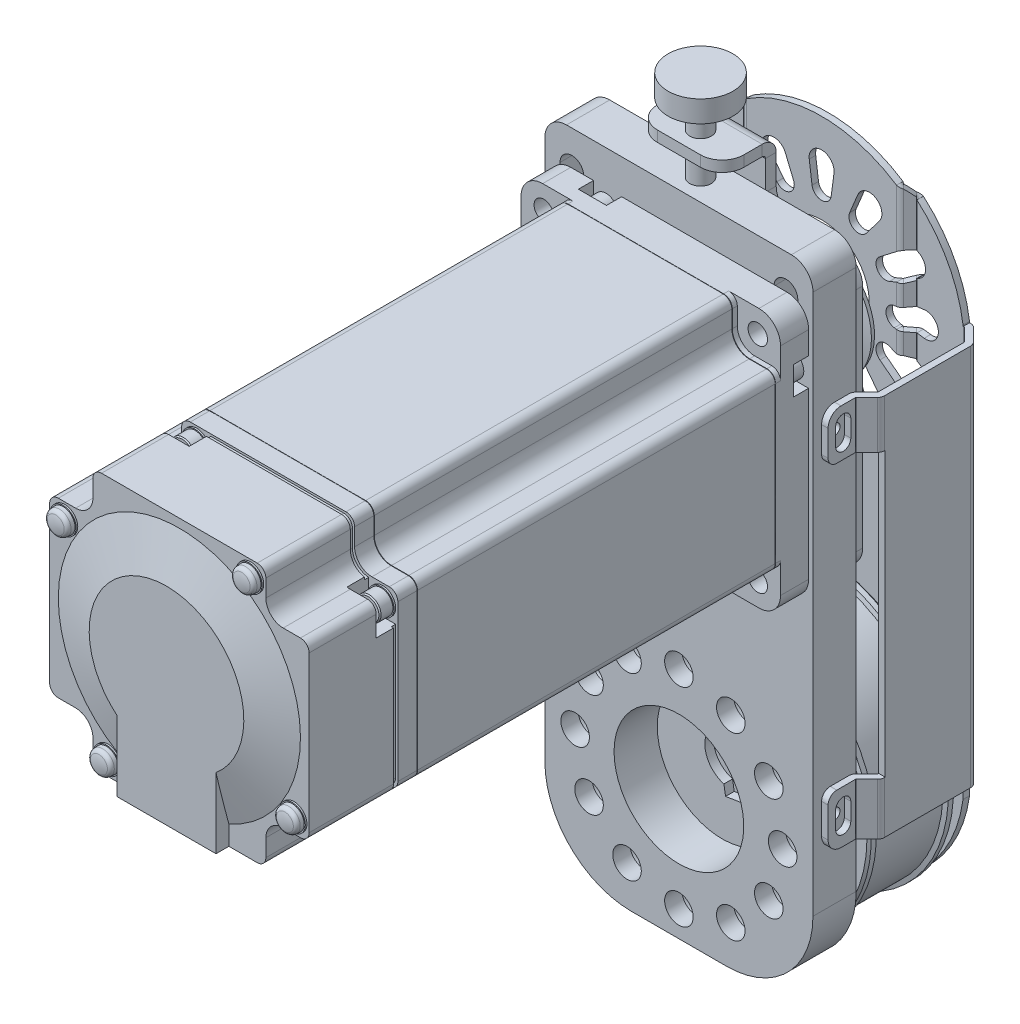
SolidWorks part; units mm, degrees
ref_plane "前视基准面" through (0, 0, 0) normal (0, 0, 1) x (1, 0, 0)
ref_plane "上视基准面" through (0, 0, 0) normal (0, 1, 0) x (1, 0, 0)
ref_plane "右视基准面" through (0, 0, 0) normal (1, 0, 0) x (0, 0, -1)
imported_body "15-1-surface1"
imported_body "15-1-surface2"
imported_body "15-1-surface3"
imported_body "15-1-surface4"
imported_body "15-1-surface5"
imported_body "RYK60欧规皮带模组转折电机板松下400W-1-surface1"
imported_body "3M65齿15宽内孔12键5-1-surface1"
imported_body "欧规皮带模组电机罩-1-surface1"
imported_body "3M15宽26齿14内孔同步轮单边凸台-1-surface1"
imported_body "3M15宽26齿14内孔同步轮单边凸台-1-surface2"
imported_body "3M15宽26齿14内孔同步轮单边凸台-1-surface3"
imported_body "3M15宽26齿14内孔同步轮单边凸台-1-surface4"
imported_body "3M15宽26齿14内孔同步轮单边凸台-1-surface5"
imported_body "3M15宽26齿14内孔同步轮单边凸台-1-surface6"
imported_body "3M15宽26齿14内孔同步轮单边凸台-1-surface7"
imported_body "3M15宽26齿14内孔同步轮单边凸台-1-surface8"
imported_body "欧规皮带模组400W拉紧板-1-surface1"
imported_body "M5手拧螺丝-1-surface1"
sketch "草图1" plane through (0, 0, -22) normal (0, 0, -1) x (-1, 0, 0)
  circle A0 centre (0, -45) radius 31.0098
  circle A1 centre (0, 37) radius 12.3478
extrude "凸台-拉伸1" add sketch "草图1" against normal blind 18
